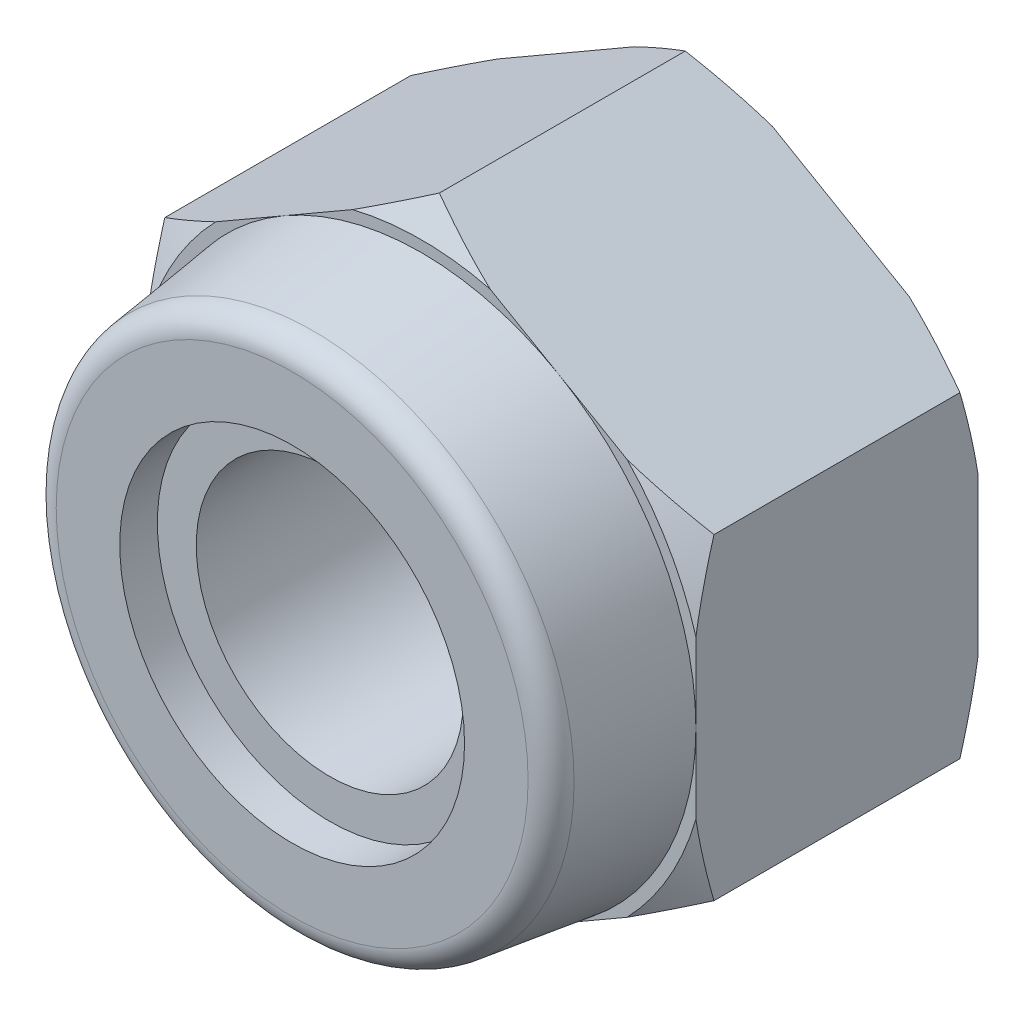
SolidWorks part; units mm, degrees
ref_plane "Front" through (0, 0, 0) normal (0, 0, 1) x (1, 0, 0)
ref_plane "Top" through (0, 0, 0) normal (0, 1, 0) x (1, 0, 0)
ref_plane "Right" through (0, 0, 0) normal (1, 0, 0) x (0, 0, -1)
sketch "BaseNutSke" plane through (0, 0, 0) normal (0, 0, 1) x (1, 0, 0)
  line L1 (5.5626, -3.2116) -> (5.5626, 3.2116)
  line L2 (5.5626, 3.2116) -> (0, 6.4231)
  line L3 (0, 6.4231) -> (-5.5626, 3.2116)
  line L4 (-5.5626, 3.2116) -> (-5.5626, -3.2116)
  line L5 (-5.5626, -3.2116) -> (0, -6.4231)
  line L12 (0, -6.4231) -> (5.5626, -3.2116)
  circle A0 centre (0, 0) radius 2.7051
  circle A2 centre (0, 0) radius 5.5626 construction
  dimension "Tap_Drill" = 5.4102
  dimension "A" = 11.1252
extrude "BaseNut" add sketch "BaseNutSke" against normal blind 5.715
sketch "TorqEleSke" plane through (0, 0, 0) normal (0, 1, 0) x (0, 0, -1)
  line L0 (-9.4809, 0) -> (15.875, 0) construction
  line L1 (0, 0) -> (0, 5.5626) construction
  line L2 (-1.8542, 3.4925) -> (-1.8542, 2.7051)
  line L3 (0, 2.7051) -> (0, 5.5626)
  line L4 (0, 5.5626) -> (-2.1815, 5.2754)
  line L5 (-1.8542, 2.7051) -> (0, 2.7051)
  line L6 (-1.8542, 3.4925) -> (-2.6162, 3.4925)
  line L7 (-2.6162, 3.4925) -> (-2.6162, 4.7797)
  line L10 (0, -5.5626) -> (0, 0) construction
  line L11 (5.715, -5.5626) -> (5.715, 0) construction
  arc A0 (-2.6162, 4.7797) -> (-2.1815, 5.2754) centre (-2.1162, 4.7797) cw
revolve "TorqueElement" add sketch "TorqEleSke" angle 360 about L0
sketch "Sketch3" plane through (0, 0, 0) normal (1, 0, 0) x (0, 0, -1)
  line L0 (5.715, 5.7881) -> (5.3484, 6.4231)
  line L1 (0, 6.4231) -> (0, 5.7881)
  line L2 (5.3484, 6.4231) -> (5.715, 6.4231)
  line L3 (5.715, 6.4231) -> (5.715, 5.7881)
  line L4 (0.3666, 6.4231) -> (0, 6.4231)
  line L5 (0, 5.7881) -> (0.3666, 6.4231)
  line L7 (0, 0) -> (38.6776, 0) construction
  line L9 (2.8575, 4.0415) -> (2.8575, 50004.0415) construction
  line L15 (5.715, 6.4231) -> (0, 6.4231) construction
  point P23 (2.8575, 6.4231)
revolve "DoubleChamfer" cut sketch "Sketch3" angle 360 about L7
sketch "ThdSchSke" plane through (0, 0, 0) normal (0, 1, 0) x (1, 0, 0)
  line L0 (-3.175, 5.715) -> (-2.7051, 5.9863)
  line L1 (-3.175, 5.715) -> (-50003.175, 5.715) construction
  line L2 (-2.7051, 5.9863) -> (-2.7051, 5.4437)
  line L3 (2.7051, 5.715) -> (-2.7051, 5.715) construction
  line L4 (-2.7051, 5.4437) -> (-3.175, 5.715)
  line L6 (0, -1.4815) -> (0, -2.9874) construction
  line L7 (-2.7051, 5.715) -> (-2.7051, -1.8542) construction
revolve "ThreadSchematic" cut sketch "ThdSchSke" angle 360 about L6
pattern_linear "ThdSchPat" [suppressed]
equation "\"Inset_Dia@TorqEleSke\" = \"ThreadSize@ThdSchSke\" * 1.1"
equation "\"D3@TorqEleSke\" = \"ThreadSize@ThdSchSke\" * .12"
equation "\"ChamferLen@Sketch3\"=\"ThreadSize@ThdSchSke\"*.1"
